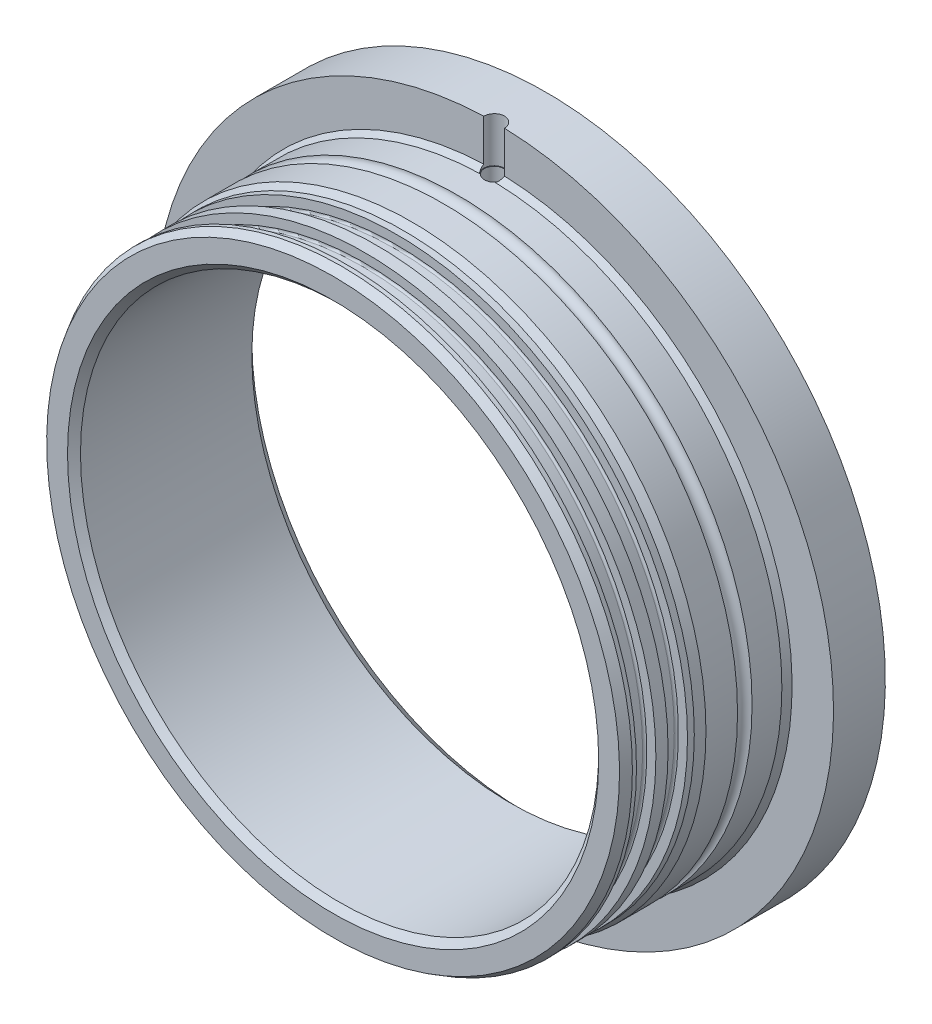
SolidWorks part; units mm, degrees
ref_plane "Front Plane" through (0, 0, 0) normal (0, 0, 1) x (1, 0, 0)
ref_plane "Top Plane" through (0, 0, 0) normal (0, 1, 0) x (1, 0, 0)
ref_plane "Right Plane" through (0, 0, 0) normal (1, 0, 0) x (0, 0, -1)
imported_body "Imported1"
ref_plane "Plane1" through (0, 0, -6.9298) normal (0, 0, 1) x (1, 0, 0)
sketch "Sketch1" plane through (0, 0, -6.9298) normal (0, 0, 1) x (1, 0, 0)
  circle A0 centre (0, 0) radius 138.255
extrude "Cut-Extrude1" cut sketch "Sketch1" against normal through all
sketch "Sketch2" plane through (0, 0, -6.9298) normal (0, 0, -1) x (-1, 0, 0)
  line L0 (0, 62.3462) -> (0, 83.185)
  circle A0 centre (0, 0) radius 62.3462 construction
  circle A1 centre (0, 0) radius 83.185 construction
ref_plane "Plane2" through (0, 0, 0) normal (-1, 0, 0) x (0, 1, 0)
sketch "Sketch5" plane through (0, 0, -6.9298) normal (0, 0, -1) x (-1, 0, 0)
  circle A0 centre (0, 0) radius 63.5
  dimension "D1" = 127
extrude "Cut-Extrude2" cut sketch "Sketch5" against normal through all
sketch "Sketch6" plane through (0, 0, 27.4584) normal (0, 0, 1) x (1, 0, 0)
  circle A0 centre (0, 0) radius 66.675
chamfer "Chamfer2" distance 3.175 angle 45 1 edges at (-63.5, 0, -6.9298)
ref_plane "Plane3" through (0, 0, 8.9588) normal (0, 0, 1) x (1, 0, 0)
ref_plane "Plane4" through (0, 0, 8.1968) normal (0, 0, 1) x (1, 0, 0)
sketch "Sketch7" plane through (0, 0, 8.9588) normal (0, 0, 1) x (1, 0, 0)
  circle A0 centre (0, 0) radius 71.35
  circle A1 centre (-0.8749, 0) radius 73.4188
extrude "Cut-Extrude3" cut sketch "Sketch7" against normal up to surface (0.762 mm away)
sketch "Sketch9" plane through (0, 0, 0) normal (-1, 0, 0) x (0, 1, 0)
  line L0 (72.112, -8.1968) -> (71.35, -10.2904)
  line L1 (71.35, -11.9588) -> (71.35, -8.1968) construction
  line L2 (71.35, -10.2904) -> (71.35, -8.1968)
  line L3 (-72.112, -8.1968) -> (72.112, -8.1968) construction
  line L4 (71.35, -8.1968) -> (72.112, -8.1968)
  line L5 (0, 0) -> (0, 43.1348)
  dimension "D1" = 20
revolve "Revolve1" add sketch "Sketch9" angle 360 about L5
fillet "Fillet1" radius 0.508 4 edges at (68.6181, 0, 11.9588) (68.6181, 0, 16.7086) (68.6181, 0, 19.7086) (68.6181, 0, 24.4584)
sketch "Sketch10" plane through (0, 0, 0) normal (-1, 0, 0) x (0, 1, 0)
  line L0 (72.112, -8.1968) -> (72.112, -5.1968)
  line L1 (72.112, -1.6368) -> (72.112, 1.8332)
  line L2 (-83.185, 1.8332) -> (83.185, 1.8332) construction
  line L3 (-72.112, 1.8332) -> (72.112, 1.8332) construction
  line L4 (72.112, 1.8332) -> (64.8728, 1.8332)
  line L5 (64.8728, 1.8332) -> (64.8728, -8.1968)
  line L6 (72.112, -8.1968) -> (-72.112, -8.1968) construction
  line L7 (64.8728, -8.1968) -> (72.112, -8.1968)
  line L8 (72.112, -5.1968) -> (72.112, -1.6368)
  line L9 (0, 0) -> (0, 39.616)
  circle A0 centre (72.112, -3.4168) radius 1.778
revolve "Revolve2" add sketch "Sketch10" angle 360 about L9
ref_plane "Plane5" through (0, 72.112, 0) normal (0, 1, 0) x (1, 0, 0)
sketch "Sketch13" plane through (0, 0, 0) normal (-1, 0, 0) x (0, 1, 0)
  line L0 (-72.112, 1.8332) -> (-72.112, -8.1968) construction
  line L1 (-83.185, 1.8332) -> (83.185, 1.8332) construction
  line L2 (0, 1.8332) -> (0, -63.2196)
  line L3 (-72.112, 1.8332) -> (72.112, 1.8332) construction
  circle A0 centre (-72.112, -8.8348) radius 1.778
  point P4 (-72.112, -7.0568)
  dimension "D1" = 3.556
  dimension "D2" = 8.89
sketch "Sketch14" plane through (0, 0, -6.9298) normal (0, 0, -1) x (-1, 0, 0)
  circle A0 centre (0, 0) radius 83.185
extrude "Cut-Extrude6" cut sketch "Sketch14" against normal up to surface (5.0966 mm away)
sketch "Sketch15" plane through (0, 0, -1.8332) normal (0, 0, -1) x (-1, 0, 0)
  circle A0 centre (0, 0) radius 72.112
  circle A1 centre (0, 0) radius 63.5
extrude "Boss-Extrude1" add sketch "Sketch15" along normal blind 10.16
sketch "Sketch16" plane through (0, 0, -11.9932) normal (0, 0, -1) x (-1, 0, 0)
  circle A0 centre (0, 0) radius 63.5
  circle A1 centre (0, 0) radius 83.185
  dimension "D1" = 166.37
extrude "Boss-Extrude2" add sketch "Sketch16" along normal blind 12.7
sketch "Sketch19" plane through (0, 72.112, 0) normal (0, 1, 0) x (1, 0, 0)
  line L0 (-72.112, 11.9932) -> (72.112, 11.9932) construction
  circle A0 centre (0, 11.9932) radius 2.54
extrude "Cut-Extrude8" cut sketch "Sketch19" along normal through all
sketch "Sketch20" plane through (0, 72.112, 0) normal (0, 1, 0) x (1, 0, 0)
  circle A0 centre (0, 11.9932) radius 2.3813
extrude "Cut-Extrude9" cut sketch "Sketch20" against normal blind 3.429
chamfer "Chamfer5" distance 3.175 angle 45 1 edges at (-63.5, 0, -24.6932)
sketch "Sketch21" plane through (0, 0, 0) normal (-1, 0, 0) x (0, 1, 0)
  line L0 (72.112, 11.9932) -> (72.112, 0.7076)
  line L1 (72.112, -8.1968) -> (72.112, 9.6119) construction
  line L2 (0, 0) -> (0, 63.7824)
  circle A0 centre (72.112, 1.3252) radius 1.778
  point P7 (72.112, 3.1032)
  dimension "D1" = 3.556
  dimension "D2" = 8.89
revolve "Cut-Revolve3" cut sketch "Sketch21" angle 360 about L2
sketch "Sketch24" plane through (0, 0, 0) normal (-1, 0, 0) x (0, 1, 0)
  line L0 (63.5, 19.2957) -> (83.185, 19.2957)
  line L1 (63.5, -27.4584) -> (63.5, 21.5182) construction
  line L2 (83.185, 14.5332) -> (83.185, 24.6932) construction
  line L3 (83.185, 14.5332) -> (72.112, 14.5332)
  line L4 (72.112, 11.9932) -> (72.112, 14.5332) construction
  line L5 (76.835, 14.5332) -> (76.835, 24.6932)
  line L6 (83.185, 24.6932) -> (-83.185, 24.6932) construction
  line L7 (83.185, 14.5332) -> (83.185, 24.6932)
  line L8 (63.5, 19.2957) -> (63.5, 26.4424)
  line L9 (63.5, 26.4424) -> (76.835, 26.4424)
  line L10 (76.835, 26.4424) -> (76.835, 24.6932)
  spline S0 degree 2 poles (83.1462, 11.9932) (83.1462, 13.2629) (83.185, 14.5332) knots 0.492365 0.492365 0.492365 1 1 1 weights 0.083146 0.084436 0.085725 construction
  dimension "D1" = 4.7625
  dimension "D2" = 6.35
revolve "Cut-Revolve4" cut sketch "Sketch24" angle 360 about L2
chamfer "Chamfer6" distance 3.175 angle 45 1 edges at (0, 63.5, -19.2957)
chamfer "Chamfer7" distance 1.5875 angle 30 3 edges at (0, -72.112, -11.9932) (-2.3813, 72.0923, -11.9932) (2.3812, 72.0923, -11.9932)
chamfer "Chamfer8" distance 1.5875 angle 45 1 edges at (0, 76.835, -19.2957)
chamfer "Chamfer9" distance 1.5875 angle 45 1 edges at (-63.5, 0, 27.4584)
